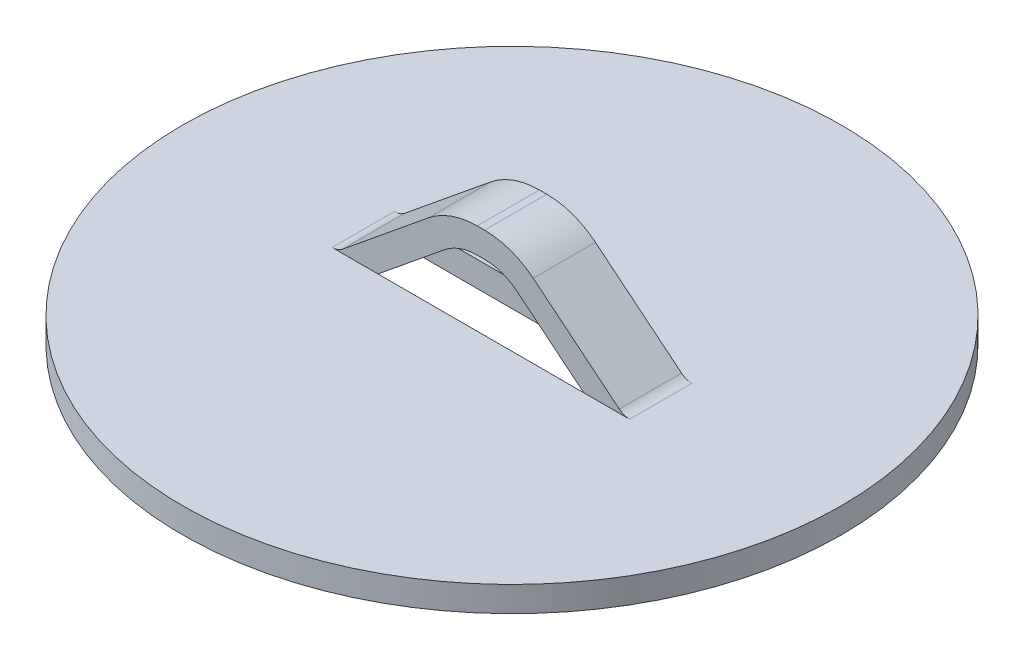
SolidWorks part; units mm, degrees
ref_plane "Front Plane" through (0, 0, 0) normal (0, 0, 1) x (1, 0, 0)
ref_plane "Top Plane" through (0, 0, 0) normal (0, 1, 0) x (1, 0, 0)
ref_plane "Right Plane" through (0, 0, 0) normal (1, 0, 0) x (0, 0, -1)
sketch "Sketch1" plane through (0, 0, 0) normal (0, 0, 1) x (1, 0, 0)
  line L0 (-15.875, 0) -> (-7.1639, 0)
  line L1 (0, 0) -> (0, -22.6791) construction
  line L2 (-6.6661, 0.1774) -> (-2.5225, 3.5589)
  line L3 (-0.1778, 4.3942) -> (0.1778, 4.3942)
  line L4 (2.5225, 3.5589) -> (6.6661, 0.1774)
  line L5 (7.1639, 0) -> (15.875, 0)
  line L6 (-15.875, -1.2192) -> (-7.1639, -1.2192)
  line L7 (-5.8952, -0.7672) -> (-1.7516, 2.6143)
  line L8 (-0.1778, 3.175) -> (0.1778, 3.175)
  line L9 (1.7516, 2.6143) -> (5.8952, -0.7672)
  line L10 (7.1639, -1.2192) -> (15.875, -1.2192)
  line L11 (-15.875, 0) -> (-15.875, -1.2192)
  line L12 (15.875, 0) -> (15.875, -1.2192)
  arc A0 (0.1778, 4.3942) -> (2.5225, 3.5589) centre (0.1778, 0.6858) cw
  arc A1 (-2.5225, 3.5589) -> (-0.1778, 4.3942) centre (-0.1778, 0.6858) cw
  arc A2 (6.6661, 0.1774) -> (7.1639, 0) centre (7.1639, 0.7874) ccw
  arc A3 (-6.6661, 0.1774) -> (-7.1639, 0) centre (-7.1639, 0.7874) cw
  arc A4 (-5.8952, -0.7672) -> (-7.1639, -1.2192) centre (-7.1639, 0.7874) cw
  arc A5 (-1.7516, 2.6143) -> (-0.1778, 3.175) centre (-0.1778, 0.6858) cw
  arc A6 (0.1778, 3.175) -> (1.7516, 2.6143) centre (0.1778, 0.6858) cw
  arc A7 (5.8952, -0.7672) -> (7.1639, -1.2192) centre (7.1639, 0.7874) ccw
  point P7 (15.875, -0.6096)
  point P16 (6.8834, 0)
  point P19 (-6.8834, 0)
  point P34 (0, 0)
  dimension "D3" = 3.7084
  dimension "D5" = 0.7874
  dimension "D1" = 4.3942
  dimension "D2" = 13.7668
  dimension "D4" = 0.3556
  dimension "D7" = 31.75
  dimension "D6" = 1.2192
extrude "Boss-Extrude1" add sketch "Sketch1" against normal blind 2.9972
sketch "Sketch2" plane through (0, -1.2192, 0) normal (0, -1, 0) x (1, 0, 0)
  line L0 (0, 0) -> (0, -2.9972) construction
  line L1 (-0.1778, -2.9972) -> (0.1778, -2.9972) construction
  line L3 (-7.1639, 0) -> (7.1639, 0)
  line L4 (-7.1639, 0) -> (-7.1639, -2.9972)
  line L5 (-7.1639, -2.9972) -> (7.1639, -2.9972)
  line L6 (7.1639, 0) -> (7.1639, -2.9972)
  circle A0 centre (0, -1.4986) radius 15.875
extrude "Boss-Extrude2" add sketch "Sketch2" against normal up to vertex
other "DeleteFace1"
